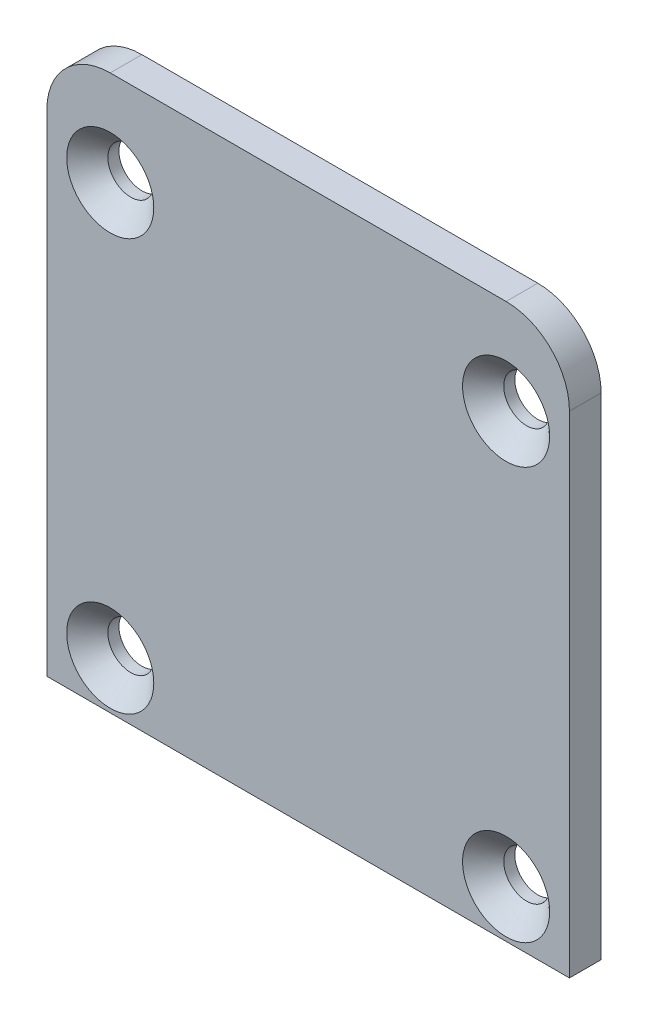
SolidWorks part; units mm, degrees
ref_plane "Plan de face" through (0, 0, 0) normal (0, 0, 1) x (1, 0, 0)
ref_plane "Plan de dessus" through (0, 0, 0) normal (0, 1, 0) x (1, 0, 0)
ref_plane "Plan de droite" through (0, 0, 0) normal (1, 0, 0) x (0, 0, -1)
sketch "Esquisse1" plane through (0, 0, 0) normal (0, 0, 1) x (1, 0, 0)
  line L1 (-12.5, 18) -> (12.5, 18)
  line L2 (-16.5, 14) -> (-16.5, -17)
  line L3 (-16.5, -17) -> (16.5, -17)
  line L4 (16.5, 14) -> (16.5, -17)
  arc A0 (12.5, 18) -> (16.5, 14) centre (12.5, 14) cw
  arc A1 (-16.5, 14) -> (-12.5, 18) centre (-12.5, 14) cw
  point P7 (16.5, 18)
  point P10 (-16.5, 18)
  dimension "D5" = 4
  dimension "D1" = 33
  dimension "D2" = 16.5
  dimension "D3" = 35
  dimension "D4" = 17
extrude "Extrusion1" add sketch "Esquisse1" along normal blind 2
hole_wizard "Fraisage pour vis à tête fraisée M2.51" positions "Esquisse3" profile "Esquisse2" countersink size "M2.5" standard "Ansi Métrique"
sketch "Esquisse3" plane through (0, 0, 2) normal (0, 0, 1) x (1, 0, 0)
  line L0 (-16.5, -17) -> (16.5, -17) construction
  point P0 (-12.5, -14)
  point P2 (12.5, -14)
  point P4 (12.5, 12)
  point P6 (-12.5, 12)
  dimension "D1" = 3
  dimension "D2" = 3
  dimension "D3" = 12.5
  dimension "D4" = 12.5
  dimension "D5" = 12.5
  dimension "D6" = 12.5
  dimension "D7" = 26
  dimension "D8" = 26
sketch "Esquisse2" plane through (-12.5, -14, 2) normal (1, 0, 0) x (0, -1, 0)
  line L0 (0, 0) -> (0, 2)
  line L1 (0, 2) -> (1.45, 2)
  line L2 (1.45, 2) -> (1.45, 1.3)
  line L3 (1.45, 1.3) -> (2.75, 0)
  line L5 (2.75, 0) -> (0, 0)
  line L6 (-1.45, 1.3) -> (-2.75, 0) construction
  line L11 (0, -6.35) -> (0, 107.95) construction
  dimension "Diamètre du perçage jusqu'au prochain" = 2.9
  dimension "Profondeur du perçage jusqu'au prochain" = 2
  dimension "Diamètre du fraisage entrant" = 5.5
  dimension "Angle du fraisage entrant" = 90
sketch "Esquisse4" plane through (0, 0, 2) normal (0, 0, 1) x (1, 0, 0)
  text T0 "Made in  Germany"
extrude "Enlèv. mat.-Extru.1" [suppressed] cut sketch "Esquisse4" against normal blind 0.2
